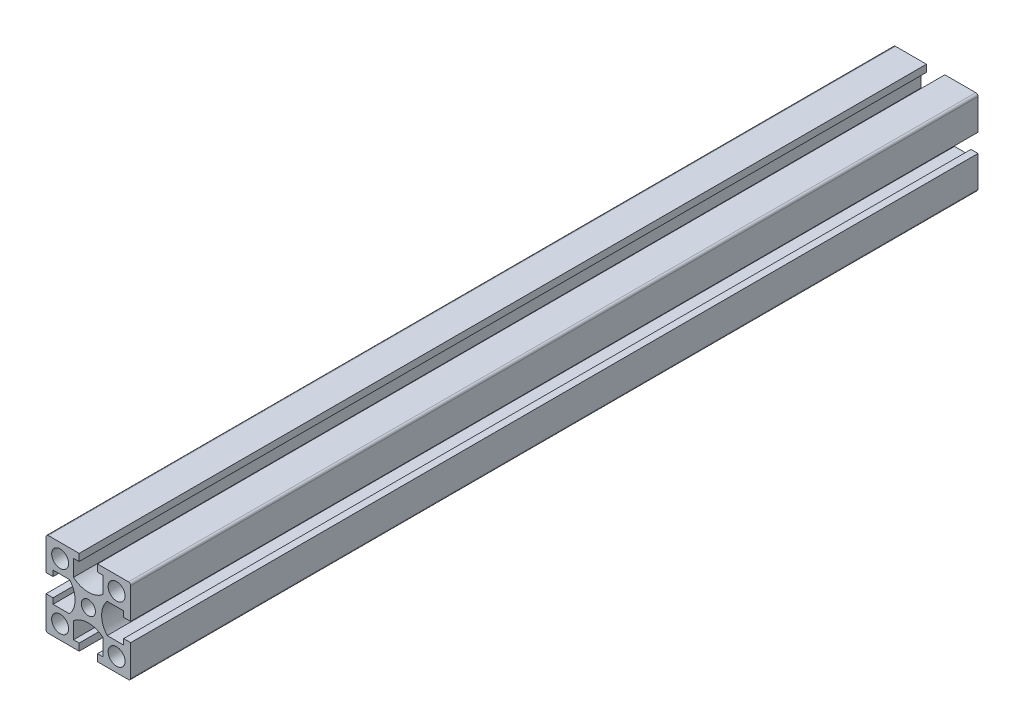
SolidWorks part; units mm, degrees
ref_plane "前视基准面" through (0, 0, 0) normal (0, 0, 1) x (1, 0, 0)
ref_plane "上视基准面" through (0, 0, 0) normal (0, 1, 0) x (1, 0, 0)
ref_plane "右视基准面" through (0, 0, 0) normal (1, 0, 0) x (0, 0, -1)
sketch "草图1" plane through (0, 0, 0) normal (0, 0, 1) x (1, 0, 0)
  line B0 (-15, 14.2) -> (-15, 3.25)
  line B1 (-15, 3.25) -> (-12.5, 3.25)
  line B2 (-12.5, 3.25) -> (-12.5, 5.25)
  line B3 (-12.5, 5.25) -> (-6.6637, 5.25)
  line B4 (-6.6637, -5.25) -> (-12.5, -5.25)
  line B5 (-12.5, -5.25) -> (-12.5, -3.25)
  line B6 (-12.5, -3.25) -> (-15, -3.25)
  line B7 (-15, -3.25) -> (-15, -14.2)
  line B8 (-14.2, -15) -> (-3.25, -15)
  line B9 (-3.25, -15) -> (-3.25, -12.5)
  line B10 (-3.25, -12.5) -> (-5.25, -12.5)
  line B11 (-5.25, -12.5) -> (-5.25, -6.6637)
  line B12 (5.25, -6.6637) -> (5.25, -12.5)
  line B13 (5.25, -12.5) -> (3.25, -12.5)
  line B14 (3.25, -12.5) -> (3.25, -15)
  line B15 (3.25, -15) -> (14.2, -15)
  line B16 (15, -14.2) -> (15, -3.25)
  line B17 (15, -3.25) -> (12.5, -3.25)
  line B18 (12.5, -3.25) -> (12.5, -5.25)
  line B19 (12.5, -5.25) -> (6.6637, -5.25)
  line B20 (6.6637, 5.25) -> (12.5, 5.25)
  line B21 (12.5, 5.25) -> (12.5, 3.25)
  line B22 (12.5, 3.25) -> (15, 3.25)
  line B23 (15, 3.25) -> (15, 14.2)
  line B24 (14.2, 15) -> (3.25, 15)
  line B25 (3.25, 15) -> (3.25, 12.5)
  line B26 (3.25, 12.5) -> (5.25, 12.5)
  line B27 (5.25, 12.5) -> (5.25, 6.6637)
  line B28 (-5.25, 6.6637) -> (-5.25, 12.5)
  line B29 (-5.25, 12.5) -> (-3.25, 12.5)
  line B30 (-3.25, 12.5) -> (-3.25, 15)
  line B31 (-3.25, 15) -> (-14.2, 15)
  arc B32 (13, -10) -> (7, -10) centre (10, -10) ccw
  arc B33 (7, -10) -> (13, -10) centre (10, -10) ccw
  arc B34 (7, 10) -> (13, 10) centre (10, 10) ccw
  arc B35 (13, 10) -> (7, 10) centre (10, 10) ccw
  arc B36 (-7, -10) -> (-13, -10) centre (-10, -10) ccw
  arc B37 (-13, -10) -> (-7, -10) centre (-10, -10) ccw
  arc B38 (-13, 10) -> (-7, 10) centre (-10, 10) ccw
  arc B39 (-7, 10) -> (-13, 10) centre (-10, 10) ccw
  arc B40 (-6.6637, -5.25) -> (-6.6637, 5.25) centre (-12.7, 0) ccw
  arc B41 (-15, -14.2) -> (-14.2, -15) centre (-14.2, -14.2) ccw
  arc B42 (5.25, -6.6637) -> (-5.25, -6.6637) centre (0, -12.7) ccw
  arc B43 (14.2, -15) -> (15, -14.2) centre (14.2, -14.2) ccw
  arc B44 (6.6637, 5.25) -> (6.6637, -5.25) centre (12.7, 0) ccw
  arc B45 (15, 14.2) -> (14.2, 15) centre (14.2, 14.2) ccw
  arc B46 (-5.25, 6.6637) -> (5.25, 6.6637) centre (0, 12.7) ccw
  arc B47 (-14.2, 15) -> (-15, 14.2) centre (-14.2, 14.2) ccw
  arc B48 (2.5, 0) -> (-2.5, 0) centre (0, 0) ccw
  arc B49 (-2.5, 0) -> (2.5, 0) centre (0, 0) ccw
sketch_block_instance "A$C64A70FB1-1"
sketch_block "A$C64A70FB1"
extrude "凸台-拉伸1" add sketch "草图1" along normal mid plane 300
